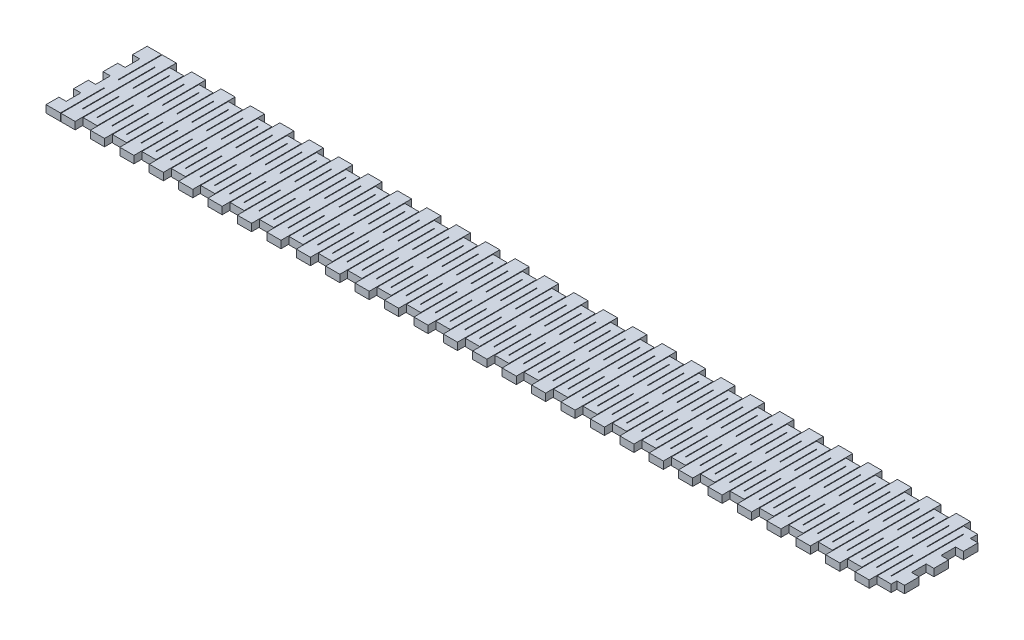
SolidWorks part; units mm, degrees
ref_plane "Front Plane" through (0, 0, 0) normal (0, 0, 1) x (1, 0, 0)
ref_plane "Top Plane" through (0, 0, 0) normal (0, 1, 0) x (1, 0, 0)
ref_plane "Right Plane" through (0, 0, 0) normal (1, 0, 0) x (0, 0, -1)
sketch "Sketch1" plane through (0, 0, 0) normal (0, 1, 0) x (1, 0, 0)
  line L1 (0, 0) -> (361.95, 0)
  line L2 (0, 0) -> (0, 43.688)
  line L3 (0, 43.688) -> (361.95, 43.688)
  line L4 (361.95, 0) -> (361.95, 43.688)
  dimension "D1" = 43.688
  dimension "D2" = 361.95
extrude "body" add sketch "Sketch1" along normal blind 3.175
sketch "Sketch2" plane through (0, 3.175, 0) normal (0, 1, 0) x (1, 0, 0)
  line L0 (6.35, 43.688) -> (6.35, 25.019) construction
  line L2 (6.477, 43.688) -> (6.477, 25.019)
  line L3 (6.223, 43.688) -> (6.223, 25.019)
  line L4 (0, 21.844) -> (361.95, 21.844) construction
  line L5 (0, 43.688) -> (0, 0) construction
  line L6 (361.95, 0) -> (361.95, 43.688) construction
  line L7 (6.35, 0) -> (6.35, 18.669) construction
  line L8 (6.477, 0) -> (6.477, 18.669)
  line L9 (6.223, 0) -> (6.223, 18.669)
  line L10 (9.525, 37.338) -> (9.525, 6.35) construction
  line L11 (9.652, 37.338) -> (9.652, 6.35)
  line L12 (9.398, 37.338) -> (9.398, 6.35)
  arc A0 (6.477, 43.688) -> (6.223, 43.688) centre (6.35, 43.688) ccw
  arc A1 (6.223, 25.019) -> (6.477, 25.019) centre (6.35, 25.019) ccw
  arc A2 (6.477, 0) -> (6.223, 0) centre (6.35, 0) cw
  arc A3 (6.223, 18.669) -> (6.477, 18.669) centre (6.35, 18.669) cw
  arc A4 (9.652, 37.338) -> (9.398, 37.338) centre (9.525, 37.338) ccw
  arc A5 (9.398, 6.35) -> (9.652, 6.35) centre (9.525, 6.35) ccw
  point P4 (6.35, 34.3535)
  point P17 (6.35, 9.3345)
  point P24 (9.525, 21.844)
  dimension "D1" = 0.254
  dimension "D2" = 0.254
  dimension "D3" = 3.175
  dimension "D4" = 6.35
  dimension "D5" = 18.669
  dimension "D6" = 30.988
extrude "slots" cut sketch "Sketch2" against normal up to surface (3.175 mm away)
sketch "Sketch4" plane through (0, 3.175, 0) normal (0, 1, 0) x (1, 0, 0)
  line L0 (0, 21.844) -> (361.95, 21.844) construction
  line L1 (361.95, 43.688) -> (6.477, 43.688) construction
  line L2 (0, 43.688) -> (0, 0) construction
  line L3 (12.7, 43.688) -> (19.05, 43.688)
  line L4 (12.7, 43.688) -> (12.7, 40.513)
  line L6 (361.95, 0) -> (361.95, 43.688) construction
  line L7 (12.7, 40.513) -> (19.05, 40.513)
  line L8 (19.05, 43.688) -> (19.05, 40.513)
  line L9 (19.05, 0) -> (19.05, 3.175)
  line L10 (12.7, 3.175) -> (19.05, 3.175)
  line L11 (12.7, 0) -> (12.7, 3.175)
  line L12 (12.7, 0) -> (19.05, 0)
  point P13 (12.7, 42.1005)
  dimension "D1" = 12.7
  dimension "D2" = 6.35
  dimension "D3" = 3.175
extrude "teeth" cut sketch "Sketch4" against normal up to surface (3.175 mm away)
pattern_linear "teeth pattern" count 28 spacing 12.7 along (1, 0, 0) of "teeth"
pattern_linear "slot pattern" count 69 spacing 6.35 along (1, 0, 0) of "slots"
sketch "Sketch5" plane through (0, 3.175, 0) normal (0, 1, 0) x (1, 0, 0)
  line L0 (0, 43.688) -> (3.175, 43.688)
  line L1 (6.223, 43.688) -> (0, 43.688) construction
  line L4 (3.175, 43.688) -> (3.1115, 0)
  line L5 (0, 0) -> (6.223, 0) construction
  line L7 (3.1115, 0) -> (0, 0)
  line L8 (0, 0) -> (0, 43.688)
  line L9 (0, 37.338) -> (3.175, 37.338)
  line L10 (0, 30.988) -> (3.175, 30.988)
  line L11 (0, 24.638) -> (3.175, 24.638)
  line L12 (0, 18.288) -> (3.175, 18.288)
  line L13 (0, 11.938) -> (3.175, 11.938)
  line L14 (0, 5.588) -> (3.175, 5.588)
  dimension "D1" = 3.175
  dimension "D2" = 7
extrude "male end" cut sketch "Sketch5" against normal up to surface (3.175 mm away) contours L8 L10 L4 L9 | L8 L12 L4 L11 | L8 L14 L4 L13
sketch "Sketch6" plane through (0, 3.175, 0) normal (0, 1, 0) x (1, 0, 0)
  line L0 (342.773, 43.688) -> (359.2085, 43.688) construction
  line L1 (361.95, 21.844) -> (365.125, 21.844) construction
  line L3 (361.95, 18.796) -> (361.95, 24.892) construction
  line L4 (365.125, 43.688) -> (360.2888, 43.688)
  line L5 (360.2888, 43.688) -> (360.2888, 0)
  line L6 (360.2888, 0) -> (365.125, 0)
  line L7 (365.125, 0) -> (365.125, 43.688)
  line L8 (365.125, 37.338) -> (360.2888, 37.338)
  line L9 (365.125, 30.988) -> (360.2888, 30.988)
  line L10 (365.125, 24.638) -> (360.2888, 24.638)
  line L11 (365.125, 18.288) -> (360.2888, 18.288)
  line L12 (365.125, 11.938) -> (360.2888, 11.938)
  line L13 (365.125, 5.588) -> (360.2888, 5.588)
  dimension "D1" = 3.175
  dimension "D2" = 7
extrude "female end" add sketch "Sketch6" against normal up to surface (3.175 mm away) contours L9 L7 L8 L5 | L11 L7 L10 L5 | L13 L7 L12 L5
